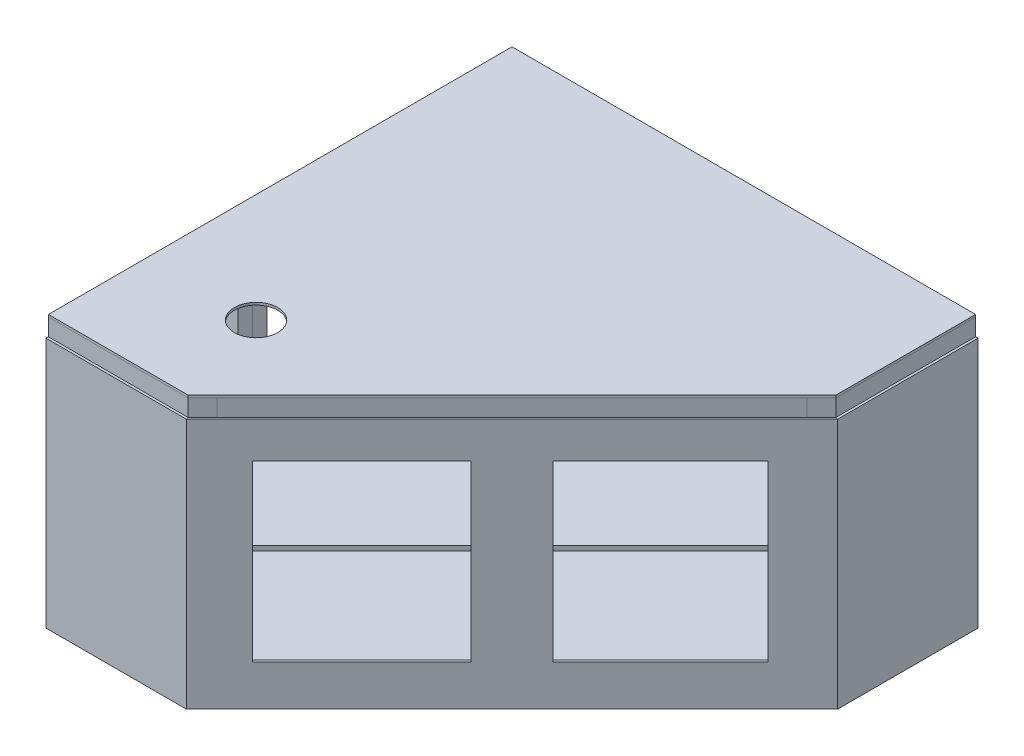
SolidWorks part; units mm, degrees
other "Top Plate"
ref_plane "Front Plane" through (0, 0, 0) normal (0, 0, 1) x (1, 0, 0)
ref_plane "Top Plane" through (0, 0, 0) normal (0, 1, 0) x (1, 0, 0)
ref_plane "Right Plane" through (0, 0, 0) normal (1, 0, 0) x (0, 0, -1)
sketch "Sketch1" plane through (0, 0, 0) normal (0, 1, 0) x (1, 0, 0)
  line L0 (0, 1219.2) -> (1219.2, 1219.2) construction
  line L5 (0, 1219.2) -> (0, 0) construction
  line L6 (0, 0) -> (366.7125, 0) construction
  line L7 (366.7125, 0) -> (1219.2, 852.4875) construction
  line L8 (1219.2, 852.4875) -> (1219.2, 1219.2) construction
  line L9 (0, 38.1) -> (404.8125, 38.1) construction
  line L10 (1181.1, 1219.2) -> (1181.1, 814.3875) construction
  line L11 (350.931, 38.1) -> (1181.1, 868.269) construction
  line L12 (38.1, 1219.2) -> (38.1, 38.1) construction
  line L13 (38.1, 1181.1) -> (1181.1, 1181.1) construction
  line L14 (38.1, 76.2) -> (389.031, 76.2) construction
  line L15 (1143, 1181.1) -> (1143, 830.169) construction
  line L16 (335.1494, 76.2) -> (1143, 884.0506) construction
  line L17 (76.2, 1181.1) -> (76.2, 76.2) construction
  line L18 (76.2, 1143) -> (1143, 1143) construction
  line L19 (752.5451, 439.7141) -> (38.1, 1154.1592) construction
  line L20 (779.4859, 466.6549) -> (65.0408, 1181.1) construction
  line L21 (766.0155, 453.1845) -> (682.2219, 536.9781) construction
  line L22 (752.5451, 493.5957) -> (744.8398, 1181.1) construction
  line L23 (782.9422, 1181.1) -> (790.8224, 477.9914) construction
  line L24 (725.6043, 466.6549) -> (38.1, 466.6549) construction
  line L25 (741.3859, 428.5549) -> (38.1, 428.5549) construction
  point P11 (1181.1, 1016.7937)
  dimension "D1" = 1219.2
  dimension "D2" = 1219.2
  dimension "D3" = 366.7125
  dimension "D4" = 38.1
  dimension "D5" = 38.1
  dimension "D6" = 38.1
  dimension "D7" = 38.1
  dimension "D8" = 38.1
  dimension "D9" = 38.1
  dimension "D10" = 38.1
  dimension "D11" = 38.1
  dimension "D12" = 38.1
  dimension "D13" = 38.1
  dimension "D14" = 19.05
  dimension "D15" = 19.05
  dimension "D16" = 38.1
  dimension "D17" = 38.1
sketch "Sketch2" plane through (0, 0, 0) normal (0, 1, 0) x (1, 0, 0)
  line L0 (1181.1, 1219.2) -> (1219.2, 1219.2)
  line L1 (0, 1219.2) -> (38.1, 1219.2)
  line L2 (0, 1219.2) -> (0, 38.1)
  line L3 (0, 38.1) -> (38.1, 38.1)
  line L4 (38.1, 1219.2) -> (38.1, 38.1)
  line L5 (65.0408, 1181.1) -> (744.8398, 1181.1)
  line L7 (103.1408, 1143) -> (744.8398, 1143)
  line L8 (744.8398, 1181.1) -> (744.8398, 1143)
  line L9 (1219.2, 1219.2) -> (1219.2, 852.4875)
  line L10 (1219.2, 852.4875) -> (1181.1, 814.3875)
  line L11 (1181.1, 814.3875) -> (1181.1, 1219.2)
  line L12 (335.1494, 76.2) -> (389.031, 76.2)
  line L14 (1143, 830.169) -> (1143, 884.0506)
  line L16 (779.4859, 466.6549) -> (65.0408, 1181.1) construction
  line L17 (65.0408, 1181.1) -> (103.1408, 1143)
  line L18 (335.1494, 76.2) -> (687.5043, 428.5549)
  line L19 (687.5043, 428.5549) -> (741.3859, 428.5549)
  line L20 (741.3859, 428.5549) -> (389.031, 76.2)
  line L21 (741.3859, 428.5549) -> (38.1, 428.5549) construction
  line L22 (335.1494, 76.2) -> (1143, 884.0506) construction
  line L23 (1143, 830.169) -> (790.8224, 477.9914)
  line L24 (790.8224, 477.9914) -> (790.2252, 531.2758)
  line L25 (790.2252, 531.2758) -> (1143, 884.0506)
  line L27 (782.9422, 1181.1) -> (790.8224, 477.9914) construction
  line L35 (782.9422, 1181.1) -> (1143, 1181.1)
  line L36 (782.9422, 1181.1) -> (782.9422, 1143)
  line L37 (782.9422, 1143) -> (1143, 1143)
  line L38 (1143, 1181.1) -> (1143, 1143)
extrude "Boss-Extrude6" add sketch "Sketch2" along normal blind 88.9
sketch "Sketch3" plane through (0, 0, 0) normal (0, 1, 0) x (1, 0, 0)
  line L0 (1181.1, 868.269) -> (1181.1, 814.3875)
  line L1 (38.1, 1219.2) -> (1181.1, 1219.2)
  line L2 (38.1, 1219.2) -> (38.1, 1181.1)
  line L3 (38.1, 1181.1) -> (1181.1, 1181.1)
  line L4 (1181.1, 1219.2) -> (1181.1, 1181.1)
  line L5 (1181.1, 814.3875) -> (404.8125, 38.1)
  line L6 (404.8125, 38.1) -> (350.931, 38.1)
  line L7 (350.931, 38.1) -> (1181.1, 868.269)
extrude "Boss-Extrude7" add sketch "Sketch3" along normal blind 88.9 separate body
sketch "Sketch6" plane through (0, 0, 0) normal (0, 1, 0) x (1, 0, 0)
  line L0 (752.5451, 439.7141) -> (779.4859, 466.6549)
  line L1 (779.4859, 466.6549) -> (65.0408, 1181.1)
  line L2 (65.0408, 1181.1) -> (38.1, 1181.1)
  line L3 (38.1, 1181.1) -> (38.1, 1154.1592)
  line L4 (38.1, 1154.1592) -> (752.5451, 439.7141)
  line L5 (1143, 1181.1) -> (1143, 830.169)
  line L6 (1143, 830.169) -> (1181.1, 868.269)
  line L7 (1181.1, 868.269) -> (1181.1, 1181.1)
  line L8 (1181.1, 1181.1) -> (1143, 1181.1)
  line L9 (38.1, 76.2) -> (389.031, 76.2)
  line L10 (389.031, 76.2) -> (350.931, 38.1)
  line L11 (350.931, 38.1) -> (38.1, 38.1)
  line L12 (38.1, 38.1) -> (38.1, 76.2)
extrude "Boss-Extrude8" add sketch "Sketch6" along normal blind 88.9 separate body
sketch "Sketch7" plane through (0, 0, 0) normal (0, 1, 0) x (1, 0, 0)
  line L0 (744.8398, 1181.1) -> (782.9422, 1181.1)
  line L1 (782.9422, 1181.1) -> (790.8224, 477.9914)
  line L2 (790.8224, 477.9914) -> (779.4859, 466.6549)
  line L3 (779.4859, 466.6549) -> (752.5451, 493.5957)
  line L4 (752.5451, 493.5957) -> (744.8398, 1181.1)
  line L5 (38.1, 466.6549) -> (725.6043, 466.6549)
  line L6 (725.6043, 466.6549) -> (752.5451, 439.7141)
  line L7 (752.5451, 439.7141) -> (741.3859, 428.5549)
  line L8 (741.3859, 428.5549) -> (38.1, 428.5549)
  line L9 (38.1, 428.5549) -> (38.1, 466.6549)
  line L10 (0, 38.1) -> (404.8125, 38.1)
  line L11 (404.8125, 38.1) -> (366.7125, 0)
  line L12 (366.7125, 0) -> (0, 0)
  line L13 (0, 0) -> (0, 38.1)
extrude "Boss-Extrude9" add sketch "Sketch7" along normal blind 88.9 separate body
sketch "Sketch8" plane through (0, 0, 0) normal (0, 1, 0) x (1, 0, 0)
  line L0 (38.1, 1154.1592) -> (76.2, 1116.0592)
  line L1 (76.2, 1181.1) -> (76.2, 76.2) construction
  line L2 (76.2, 1116.0592) -> (76.2, 466.6549)
  line L3 (725.6043, 466.6549) -> (38.1, 466.6549) construction
  line L4 (76.2, 466.6549) -> (38.1, 466.6549)
  line L5 (38.1, 466.6549) -> (38.1, 1154.1592)
  line L6 (752.5451, 439.7141) -> (38.1, 1154.1592) construction
  line L8 (38.1, 428.5549) -> (76.2, 428.5549)
  line L9 (38.1, 428.5549) -> (38.1, 76.2)
  line L10 (38.1, 76.2) -> (76.2, 76.2)
  line L11 (76.2, 428.5549) -> (76.2, 76.2)
extrude "Boss-Extrude10" add sketch "Sketch8" along normal blind 88.9 separate body
sketch "Sketch9" plane through (0, 0, 0) normal (0, -1, 0) x (1, 0, 0)
  line L0 (0, -1219.2) -> (0, -38.1) construction
  line L1 (38.1, -1219.2) -> (114.3, -1219.2) construction
  line L2 (38.1, -1219.2) -> (38.1, -1130.3) construction
  line L3 (38.1, -1130.3) -> (114.3, -1130.3) construction
  line L4 (114.3, -1219.2) -> (114.3, -1130.3) construction
  line L5 (0, -1130.3) -> (88.9, -1130.3) construction
  line L6 (0, -1130.3) -> (0, -1054.1) construction
  line L7 (0, -1054.1) -> (88.9, -1054.1) construction
  line L8 (88.9, -1130.3) -> (88.9, -1054.1) construction
  line L9 (782.9422, -1143) -> (1143, -1143) construction
  line L10 (1219.2, -1219.2) -> (1130.3, -1219.2) construction
  line L11 (1219.2, -1219.2) -> (1219.2, -1143) construction
  line L12 (1219.2, -1143) -> (1130.3, -1143) construction
  line L13 (1130.3, -1219.2) -> (1130.3, -1143) construction
  line L14 (76.2, -76.2) -> (76.2, -428.5549) construction
  line L15 (76.2, -88.9) -> (0, -88.9) construction
  line L16 (76.2, -88.9) -> (76.2, 0) construction
  line L17 (76.2, 0) -> (0, 0) construction
  line L18 (0, -88.9) -> (0, 0) construction
  line L26 (766.0155, -399.303) -> (819.897, -453.1845) construction
  line L27 (404.8125, -38.1) -> (1181.1, -814.3875) construction
  line L28 (819.897, -453.1845) -> (757.0352, -516.0463) construction
  line L29 (757.0352, -516.0463) -> (703.1537, -462.1648) construction
  line L30 (703.1537, -462.1648) -> (766.0155, -399.303) construction
  line L31 (792.9563, -426.2438) -> (730.0945, -489.1055) construction
  line L32 (420.594, -53.8815) -> (357.7322, -116.7433) construction
  line L33 (357.7322, -116.7433) -> (303.8507, -62.8618) construction
  line L34 (303.8507, -62.8618) -> (366.7125, 0) construction
  line L35 (366.7125, 0) -> (404.8125, -38.1) construction
  line L36 (366.7125, 0) -> (420.594, -53.8815) construction
  line L37 (1219.2, -852.4875) -> (1165.3185, -798.606) construction
  line L38 (1156.3382, -915.3493) -> (1219.2, -852.4875) construction
  line L39 (1102.4567, -861.4678) -> (1156.3382, -915.3493) construction
  line L40 (1165.3185, -798.606) -> (1102.4567, -861.4678) construction
  line L41 (1181.1, -1219.2) -> (38.1, -1219.2) construction
  line L42 (725.791, -1219.2) -> (801.991, -1219.2) construction
  line L43 (725.791, -1219.2) -> (725.791, -1130.3) construction
  line L44 (725.791, -1130.3) -> (801.991, -1130.3) construction
  line L45 (801.991, -1219.2) -> (801.991, -1130.3) construction
  line L46 (763.891, -1219.2) -> (763.891, -1181.1) construction
  line L47 (0, -409.5049) -> (88.9, -409.5049) construction
  line L48 (0, -409.5049) -> (0, -485.7049) construction
  line L49 (0, -485.7049) -> (88.9, -485.7049) construction
  line L50 (88.9, -409.5049) -> (88.9, -485.7049) construction
  line L51 (782.9422, -1181.1) -> (744.8398, -1181.1) construction
  line L52 (38.1, -447.6049) -> (0, -447.6049) construction
  line L53 (38.1, -466.6549) -> (38.1, -428.5549) construction
  dimension "D1" = 76.2
  dimension "D2" = 88.9
  dimension "D3" = 76.2
  dimension "D4" = 88.9
  dimension "D5" = 88.9
  dimension "D6" = 88.9
  dimension "D7" = 76.2
  dimension "D8" = 88.9
  dimension "D9" = 76.2
  dimension "D10" = 88.9
  dimension "D11" = 76.2
  dimension "D12" = 88.9
  dimension "D13" = 76.2
  dimension "D14" = 88.9
sketch "Sketch10" plane through (0, 0, 0) normal (0, -1, 0) x (1, 0, 0)
  line L0 (76.2, -88.9) -> (0, -88.9) construction
  line L1 (0, 0) -> (38.1, 0)
  line L2 (0, 0) -> (0, -88.9)
  line L3 (0, -88.9) -> (38.1, -88.9)
  line L4 (38.1, 0) -> (38.1, -88.9)
  line L5 (366.7125, 0) -> (303.8507, -62.8618)
  line L6 (366.7125, 0) -> (388.061, -21.3485)
  line L7 (303.8507, -62.8618) -> (325.1992, -84.2103)
  line L8 (388.061, -21.3485) -> (325.1992, -84.2103)
  line L9 (766.0155, -399.303) -> (703.1537, -462.1648)
  line L10 (766.0155, -399.303) -> (793.1782, -426.4657)
  line L11 (703.1537, -462.1648) -> (730.3164, -489.3275)
  line L12 (793.1782, -426.4657) -> (730.3164, -489.3275)
  line L13 (1165.3185, -798.606) -> (1102.4567, -861.4678)
  line L14 (1165.3185, -798.606) -> (1192.2592, -825.5467)
  line L15 (1102.4567, -861.4678) -> (1129.3974, -888.4085)
  line L16 (1192.2592, -825.5467) -> (1129.3974, -888.4085)
  line L17 (1130.3, -1219.2) -> (1130.3, -1143) construction
  line L18 (1130.3, -1181.1) -> (1219.2, -1181.1)
  line L19 (1130.3, -1181.1) -> (1130.3, -1219.2)
  line L20 (1130.3, -1219.2) -> (1219.2, -1219.2)
  line L21 (1219.2, -1181.1) -> (1219.2, -1219.2)
  line L22 (38.1, -1219.2) -> (114.3, -1219.2) construction
  line L23 (725.791, -1130.3) -> (763.891, -1130.3)
  line L24 (725.791, -1130.3) -> (725.791, -1219.2)
  line L25 (725.791, -1219.2) -> (763.891, -1219.2)
  line L26 (763.891, -1130.3) -> (763.891, -1219.2)
  line L27 (38.1, -1130.3) -> (76.2, -1130.3)
  line L28 (38.1, -1130.3) -> (38.1, -1219.2)
  line L29 (38.1, -1219.2) -> (76.2, -1219.2)
  line L30 (76.2, -1130.3) -> (76.2, -1219.2)
  line L31 (88.9, -1130.3) -> (88.9, -1054.1) construction
  line L32 (0, -1054.1) -> (88.9, -1054.1)
  line L33 (0, -1054.1) -> (0, -1092.2)
  line L34 (0, -1092.2) -> (88.9, -1092.2)
  line L35 (88.9, -1054.1) -> (88.9, -1092.2)
  line L36 (88.9, -409.5049) -> (88.9, -485.7049) construction
  line L37 (0, -409.5049) -> (88.9, -409.5049)
  line L38 (0, -409.5049) -> (0, -447.6049)
  line L39 (0, -447.6049) -> (88.9, -447.6049)
  line L40 (88.9, -409.5049) -> (88.9, -447.6049)
  dimension "D1" = 38.1
extrude "Columns1" add sketch "Sketch10" along normal blind 577.85 separate body
sketch "Sketch11" plane through (0, 0, 0) normal (0, -1, 0) x (1, 0, 0)
  line L0 (76.2, 0) -> (0, 0) construction
  line L1 (38.1, 0) -> (76.2, 0)
  line L2 (38.1, 0) -> (38.1, -88.9)
  line L3 (38.1, -88.9) -> (76.2, -88.9)
  line L4 (76.2, 0) -> (76.2, -88.9)
  line L5 (792.9563, -426.2438) -> (730.0945, -489.1055)
  line L6 (0, -447.6049) -> (88.9, -447.6049)
  line L7 (0, -447.6049) -> (0, -485.7049)
  line L8 (0, -485.7049) -> (88.9, -485.7049)
  line L9 (88.9, -447.6049) -> (88.9, -485.7049)
  line L10 (88.9, -1130.3) -> (0, -1130.3)
  line L11 (88.9, -1130.3) -> (88.9, -1092.2)
  line L12 (88.9, -1092.2) -> (0, -1092.2)
  line L13 (0, -1130.3) -> (0, -1092.2)
  line L14 (801.991, -1130.3) -> (763.891, -1130.3)
  line L15 (801.991, -1130.3) -> (801.991, -1219.2)
  line L16 (801.991, -1219.2) -> (763.891, -1219.2)
  line L17 (763.891, -1130.3) -> (763.891, -1219.2)
  line L18 (792.9563, -426.2438) -> (819.9118, -453.1993)
  line L19 (730.0945, -489.1055) -> (757.05, -516.0611)
  line L20 (819.9118, -453.1993) -> (757.05, -516.0611)
  line L21 (757.0352, -516.0463) -> (703.1537, -462.1648) construction
  line L22 (388.061, -21.3485) -> (325.1992, -84.2103)
  line L23 (388.061, -21.3485) -> (415.8525, -49.14)
  line L24 (325.1992, -84.2103) -> (352.9907, -112.0017)
  line L25 (415.8525, -49.14) -> (352.9907, -112.0017)
  line L26 (1192.2592, -825.5467) -> (1129.3974, -888.4085)
  line L27 (1192.2592, -825.5467) -> (1219.2, -852.4875)
  line L28 (1129.3974, -888.4085) -> (1156.3382, -915.3493)
  line L29 (1219.2, -852.4875) -> (1156.3382, -915.3493)
  line L30 (1219.2, -1219.2) -> (1219.2, -1143) construction
  line L31 (1130.3, -1143) -> (1219.2, -1143)
  line L32 (1130.3, -1143) -> (1130.3, -1181.1)
  line L33 (1130.3, -1181.1) -> (1219.2, -1181.1)
  line L34 (1219.2, -1143) -> (1219.2, -1181.1)
extrude "Columns2" add sketch "Sketch11" along normal blind 577.85 separate body
sketch "Sketch12" plane through (0, 0, 0) normal (0, -1, 0) x (-1, 0, 0)
  line L1 (-76.2, 1130.3) -> (-114.3, 1130.3)
  line L2 (-76.2, 1130.3) -> (-76.2, 1219.2)
  line L3 (-76.2, 1219.2) -> (-114.3, 1219.2)
  line L4 (-114.3, 1130.3) -> (-114.3, 1219.2)
extrude "Column3" add sketch "Sketch12" along normal blind 577.85 separate body
sketch "Sketch13" plane through (0, -577.85, 0) normal (0, -1, 0) x (1, 0, 0)
  line L0 (0, 0) -> (0, -1219.2)
  line L1 (0, -1219.2) -> (88.9, -1130.3)
  line L2 (88.9, -1130.3) -> (88.9, -88.9)
  line L3 (0, 0) -> (88.9, -88.9)
  line L4 (366.7125, 0) -> (1219.2, -852.4875)
  line L5 (1219.2, -852.4875) -> (1093.4764, -852.4875)
  line L6 (1093.4764, -852.4875) -> (366.7125, -125.7236)
  line L7 (366.7125, -125.7236) -> (366.7125, 0)
  dimension "D1" = 88.9
  dimension "D2" = 45
  dimension "D3" = 45
  dimension "D4" = 88.9
  dimension "D5" = 45
extrude "Boss-Extrude14" add sketch "Sketch13" along normal blind 38.1 separate body
sketch "Sketch14" plane through (0, -577.85, 0) normal (0, -1, 0) x (1, 0, 0)
  line L0 (0, -1219.2) -> (88.9, -1130.3)
  line L1 (88.9, -1130.3) -> (1130.3, -1130.3)
  line L2 (1130.3, -1130.3) -> (1219.2, -1219.2)
  line L3 (1219.2, -1219.2) -> (0, -1219.2)
  line L4 (366.7125, 0) -> (0, 0)
  line L5 (0, 0) -> (88.9, -88.9)
  line L8 (88.9, -88.9) -> (366.7125, -88.9)
  line L9 (366.7125, 0) -> (366.7125, -88.9)
  dimension "D1" = 45
extrude "Boss-Extrude15" add sketch "Sketch14" along normal blind 38.1 separate body
sketch "Sketch15" plane through (0, -577.85, 0) normal (0, -1, 0) x (1, 0, 0)
  line L0 (1219.2, -1219.2) -> (1130.3, -1130.3)
  line L1 (1130.3, -1130.3) -> (1130.3, -852.4875)
  line L2 (1219.2, -1219.2) -> (1219.2, -852.4875)
  line L3 (1219.2, -852.4875) -> (1130.3, -852.4875)
  line L4 (1093.4764, -852.4875) -> (1219.2, -852.4875) construction
extrude "Boss-Extrude16" add sketch "Sketch15" along normal blind 38.1 separate body
sketch3d "3DSketch2"
  line L0 (366.7125, -615.95, 0) -> (366.7125, 88.9, 0) construction
  line L1 (366.7125, -488.95, 0) -> (1219.2, -488.95, -852.4875) construction
  line L3 (366.7125, -260.35, 0) -> (1219.2, -260.35, -852.4875) construction
  line L4 (1219.2, -577.85, -852.4875) -> (1219.2, 0, -852.4875) construction
  line L5 (1219.2, -615.95, -852.4875) -> (366.7125, -615.95, 0) construction
  dimension "D1" = 127
  dimension "D2" = 228.6
sketch "Sketch16" plane through (0, -577.85, 0) normal (0, 1, 0) x (1, 0, 0)
  line L0 (0, 88.9) -> (76.2, 88.9)
  line L1 (76.2, 88.9) -> (76.2, 0)
  line L2 (76.2, 0) -> (366.7125, 0)
  line L3 (366.7125, 0) -> (303.8507, 62.8618)
  line L4 (303.8507, 62.8618) -> (352.9907, 112.0017)
  line L5 (352.9907, 112.0017) -> (415.8525, 49.14)
  line L6 (415.8525, 49.14) -> (766.0155, 399.303)
  line L7 (766.0155, 399.303) -> (703.1537, 462.1648)
  line L8 (703.1537, 462.1648) -> (757.05, 516.0611)
  line L9 (757.05, 516.0611) -> (819.9118, 453.1993)
  line L10 (819.9118, 453.1993) -> (1165.3185, 798.606)
  line L11 (1165.3185, 798.606) -> (1102.4567, 861.4678)
  line L12 (1102.4567, 861.4678) -> (1156.3382, 915.3493)
  line L13 (1156.3382, 915.3493) -> (1219.2, 852.4875)
  line L14 (1219.2, 852.4875) -> (1219.2, 1143)
  line L15 (1219.2, 1143) -> (1130.3, 1143)
  line L16 (1130.3, 1143) -> (1130.3, 1219.2)
  line L17 (1130.3, 1219.2) -> (801.991, 1219.2)
  line L18 (801.991, 1219.2) -> (801.991, 1130.3)
  line L19 (801.991, 1130.3) -> (725.791, 1130.3)
  line L20 (725.791, 1130.3) -> (725.791, 1219.2)
  line L21 (725.791, 1219.2) -> (114.3, 1219.2)
  line L22 (114.3, 1219.2) -> (114.3, 1130.3)
  line L23 (114.3, 1130.3) -> (88.9, 1130.3)
  line L24 (88.9, 1130.3) -> (88.9, 1054.1)
  line L25 (88.9, 1054.1) -> (0, 1054.1)
  line L26 (0, 1054.1) -> (0, 485.7049)
  line L27 (0, 485.7049) -> (88.9, 485.7049)
  line L28 (88.9, 485.7049) -> (88.9, 409.5049)
  line L29 (88.9, 409.5049) -> (0, 409.5049)
  line L30 (0, 409.5049) -> (0, 88.9)
extrude "Shelf1" add sketch "Sketch16" along normal blind 12.7 separate body
sketch3d "Plane2"
  line L0 (366.7125, -260.35, 0) -> (1219.2, -260.35, -852.4875) construction
sketch "Sketch18" plane through (0, -260.35, 0) normal (0, 1, 0) x (1, 0, 0)
  line L0 (0, 88.9) -> (76.2, 88.9)
  line L1 (76.2, 88.9) -> (76.2, 0)
  line L2 (76.2, 0) -> (366.7125, 0)
  line L3 (366.7125, 0) -> (303.8507, 62.8618)
  line L4 (303.8507, 62.8618) -> (352.9907, 112.0017)
  line L5 (352.9907, 112.0017) -> (415.8525, 49.14)
  line L6 (415.8525, 49.14) -> (766.0155, 399.303)
  line L7 (766.0155, 399.303) -> (703.1537, 462.1648)
  line L8 (703.1537, 462.1648) -> (757.05, 516.0611)
  line L9 (757.05, 516.0611) -> (819.9118, 453.1993)
  line L10 (819.9118, 453.1993) -> (1165.3185, 798.606)
  line L11 (1165.3185, 798.606) -> (1102.4567, 861.4678)
  line L12 (1102.4567, 861.4678) -> (1156.3382, 915.3493)
  line L13 (1156.3382, 915.3493) -> (1219.2, 852.4875)
  line L14 (1219.2, 852.4875) -> (1219.2, 1143)
  line L15 (1219.2, 1143) -> (1130.3, 1143)
  line L16 (1130.3, 1143) -> (1130.3, 1219.2)
  line L17 (1130.3, 1219.2) -> (801.991, 1219.2)
  line L18 (801.991, 1219.2) -> (801.991, 1130.3)
  line L19 (801.991, 1130.3) -> (725.791, 1130.3)
  line L20 (725.791, 1130.3) -> (725.791, 1219.2)
  line L21 (725.791, 1219.2) -> (114.3, 1219.2)
  line L22 (114.3, 1219.2) -> (114.3, 1130.3)
  line L23 (114.3, 1130.3) -> (88.9, 1130.3)
  line L24 (88.9, 1130.3) -> (88.9, 1054.1)
  line L25 (88.9, 1054.1) -> (0, 1054.1)
  line L26 (0, 1054.1) -> (0, 485.7049)
  line L27 (0, 485.7049) -> (88.9, 485.7049)
  line L28 (88.9, 485.7049) -> (88.9, 409.5049)
  line L29 (88.9, 409.5049) -> (0, 409.5049)
  line L30 (0, 409.5049) -> (0, 88.9)
extrude "Shelf2" add sketch "Sketch18" along normal blind 12.7 separate body
sketch "Sketch20" plane through (0, -565.15, 0) normal (0, 1, 0) x (1, 0, 0)
  line L0 (76.2905, 0.2076) -> (114.3905, 0.2076)
  line L1 (76.2905, 0.2076) -> (76.2905, 89.1076)
  line L2 (76.2905, 89.1076) -> (114.3905, 89.1076)
  line L3 (114.3905, 0.2076) -> (114.3905, 89.1076)
  line L4 (766.1645, 399.452) -> (703.3027, 462.3138)
  line L5 (766.1645, 399.452) -> (739.2238, 372.5113)
  line L6 (703.3027, 462.3138) -> (676.362, 435.373)
  line L7 (739.2238, 372.5113) -> (676.362, 435.373)
  line L8 (820.0608, 453.3483) -> (757.199, 516.2101)
  line L9 (820.0608, 453.3483) -> (847.0016, 480.2891)
  line L10 (757.199, 516.2101) -> (784.1398, 543.1509)
  line L11 (847.0016, 480.2891) -> (784.1398, 543.1509)
  line L12 (1219.2905, 1143.2076) -> (1130.3905, 1143.2076)
  line L13 (1219.2905, 1143.2076) -> (1219.2905, 1105.1076)
  line L14 (1219.2905, 1105.1076) -> (1130.3905, 1105.1076)
  line L15 (1130.3905, 1143.2076) -> (1130.3905, 1105.1076)
  line L16 (114.3905, 1219.4076) -> (152.4905, 1219.4076)
  line L17 (114.3905, 1219.4076) -> (114.3905, 1130.5076)
  line L18 (114.3905, 1130.5076) -> (152.4905, 1130.5076)
  line L19 (152.4905, 1219.4076) -> (152.4905, 1130.5076)
  line L20 (0.0905, 1054.3076) -> (88.9905, 1054.3076)
  line L21 (0.0905, 1054.3076) -> (0.0905, 1016.2076)
  line L22 (0.0905, 1016.2076) -> (88.9905, 1016.2076)
  line L23 (88.9905, 1054.3076) -> (88.9905, 1016.2076)
  line L24 (819.9118, 453.1993) -> (1165.3185, 798.606) construction
  dimension "D1" = 38.1
  dimension "D2" = 38.1
  dimension "D3" = 38.1
  dimension "D4" = 38.1
  dimension "D5" = 38.1
extrude "ShelfSupports" add sketch "Sketch20" along normal up to next separate body contours L7 L5 L4 L6 M11 M12 | L9 L11 L10 L8 | L15 L14 M19 M18 | L0 L3 L2 L1 | L19 L17 L18 M25 | L23 L20 L21 L22 M28 M29
sketch "Sketch30" plane through (0, -615.95, 0) normal (0, -1, 0) x (1, 0, 0)
  line L1 (0, 0) -> (366.7125, 0)
  line L2 (0, 0) -> (0, 6.35)
  line L3 (0, 6.35) -> (369.3428, 6.35)
  line L4 (366.7125, 0) -> (369.3428, 6.35)
  line L6 (792.9563, -426.2437) -> (964.2879, -254.9121) construction
  line L7 (1219.2, -852.4875) -> (366.7125, 0) construction
  line L8 (1219.2, -852.4875) -> (1225.55, -849.8572)
  line L9 (1225.55, -1219.2) -> (1225.55, -849.8572)
  line L10 (1219.2, -1219.2) -> (1225.55, -1219.2)
  line L11 (1219.2, -1219.2) -> (1219.2, -852.4875)
  dimension "D1" = 6.35
  dimension "D2" = 112.5
extrude "Side Fascia" add sketch "Sketch30" against normal blind 660.4 separate body
sketch "Sketch23" plane through (0, 44.45, 0) normal (0, 1, 0) x (1, 0, 0)
  line L0 (1225.55, 849.8572) -> (1219.2, 852.4875)
  line L1 (1219.2, 852.4875) -> (366.7125, 0)
  line L2 (366.7125, 0) -> (369.3428, -6.35)
  line L3 (369.3428, -6.35) -> (1225.55, 849.8572)
extrude "Fascia" add sketch "Sketch23" against normal up to surface (660.4 mm away) separate body contours L3 L0 L1 L2
sketch "Sketch24" plane through (183.3562, 0, 183.3562) normal (-0.7071, 0, -0.7071) x (-0.7071, 0, 0.7071)
  line L0 (-900.2255, -565.15) -> (-1388.7043, -565.15) construction
  line L1 (-1337.9043, -50.8) -> (-938.5362, -50.8)
  line L2 (-1337.9043, -50.8) -> (-1337.9043, -508)
  line L3 (-1337.9043, -508) -> (-938.5362, -508)
  line L4 (-938.5362, -50.8) -> (-938.5362, -508)
  line L5 (-379.5993, -50.8) -> (-786.1154, -50.8)
  line L6 (-379.5993, -50.8) -> (-379.5993, -508)
  line L7 (-379.5993, -508) -> (-786.1154, -508)
  line L8 (-786.1154, -50.8) -> (-786.1154, -508)
  line L9 (-1449.1227, 0) -> (-275.0864, 0) construction
  line L10 (-1388.7043, -577.85) -> (-1388.7043, 0) construction
  line L13 (-328.7993, -577.85) -> (-328.7993, 0) construction
  line L14 (-938.5362, -260.35) -> (-938.5362, -565.15) construction
  line L15 (-786.1154, -260.35) -> (-786.1154, -565.15) construction
  dimension "D1" = 57.15
  dimension "D2" = 50.8
  dimension "D3" = 50.8
  dimension "D6" = 50.8
extrude "Cabinets" cut sketch "Sketch24" against normal blind 6.35
sketch "DoorEdge" plane through (187.8464, 0, 187.8464) normal (0.7071, 0, 0.7071) x (0.7071, 0, -0.7071)
  line L0 (366.8993, -38.1) -> (366.8993, -417.5051) construction
  line L1 (1350.6043, -38.1) -> (1350.6043, -444.8584) construction
  line L2 (1337.9043, -508) -> (1337.9043, -50.8) construction
  line L3 (379.5993, -50.8) -> (379.5993, -508) construction
  line L4 (1337.9043, -50.8) -> (938.5362, -50.8) construction
  line L5 (786.1154, -50.8) -> (379.5993, -50.8) construction
  dimension "D1" = 12.7
  dimension "D2" = 12.7
  dimension "D3" = 12.7
  dimension "D4" = 12.7
sketch "Sketch28" plane through (0, 88.9, 0) normal (0, 1, 0) x (1, 0, 0)
  line L0 (0, 1219.2) -> (1219.2, 1219.2)
  line L1 (1219.2, 1219.2) -> (1219.2, 852.4875)
  line L2 (1219.2, 852.4875) -> (366.7125, 0)
  line L3 (366.7125, 0) -> (0, 0)
  line L4 (0, 0) -> (0, 1219.2)
extrude "TankPlate" add sketch "Sketch28" along normal blind 6.35 separate body
sketch "Sketch29" plane through (0, 95.25, 0) normal (0, 1, 0) x (1, 0, 0)
  line L0 (0, 0) -> (366.7125, 0) construction
  line L1 (0, 1219.2) -> (0, 0) construction
  circle A0 centre (285.75, 260.35) radius 57.15
  dimension "D1" = 114.3
  dimension "D2" = 260.35
  dimension "D3" = 285.75
extrude "Drain" cut sketch "Sketch29" against normal blind 6.35
